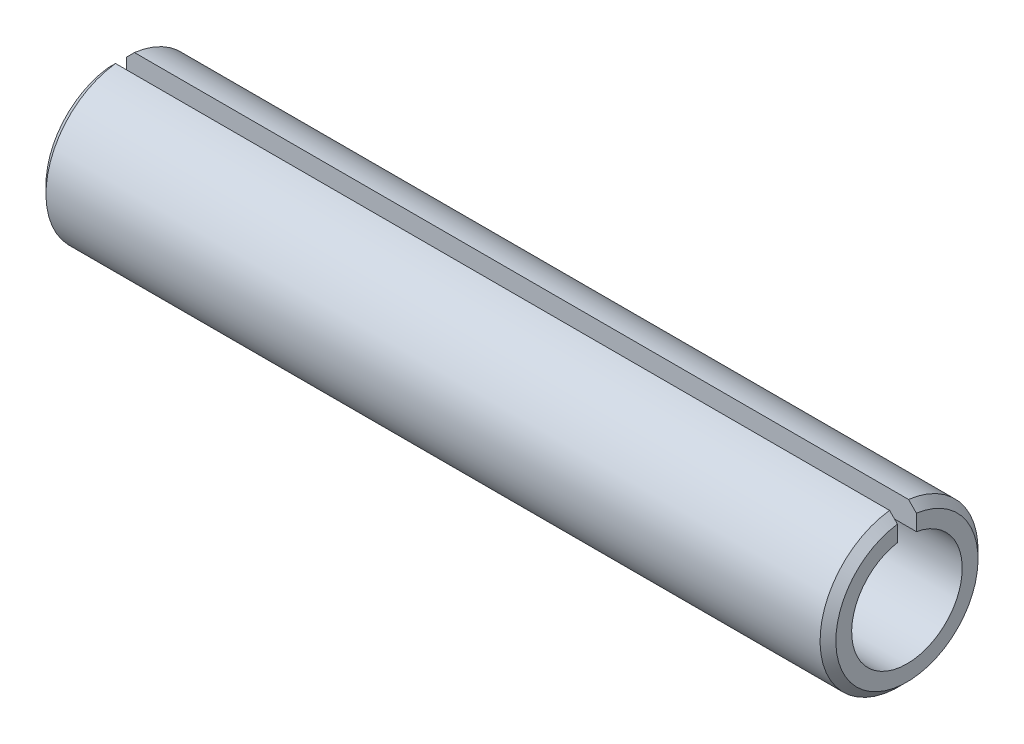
SolidWorks part; units mm, degrees
ref_plane "Plan1" through (0, 0, 0) normal (0, 0, 1) x (1, 0, 0)
ref_plane "Plan2" through (0, 0, 0) normal (0, 1, 0) x (1, 0, 0)
ref_plane "Plan3" through (0, 0, 0) normal (1, 0, 0) x (0, 0, -1)
sketch "Esquisse1" plane through (0, 0, 0) normal (0, 0, 1) x (1, 0, 0)
  line L0 (0, 1.4) -> (0, 1.8)
  line L1 (0, 1.4) -> (20, 1.4)
  line L2 (20, 1.4) -> (20, 1.8)
  line L3 (20, 1.8) -> (19.8, 2)
  line L4 (19.8, 2) -> (0.2, 2)
  line L5 (0.2, 2) -> (0, 1.8)
  line L6 (0, 0) -> (20, 0) construction
  dimension "D1" = 20
  dimension "D2" = 2
  dimension "D3" = 0.6
  dimension "D4" = 45
  dimension "D5" = 45
  dimension "D6" = 0.2
revolve "Base-Révolution" add sketch "Esquisse1" angle 360 about L6
sketch "Esquisse2" plane through (0, 0, 0) normal (1, 0, 0) x (0, 0, -1)
  line L0 (0, 0) -> (0, 2) construction
  line L1 (0.24, 1.9855) -> (0.24, 1.3793)
  line L2 (-0.24, 1.9855) -> (-0.24, 1.3793)
  circle A0 centre (0, 0) radius 2 construction
  circle A1 centre (0, 0) radius 1.4 construction
  arc A2 (0.24, 1.3793) -> (-0.24, 1.3793) centre (0, 0) ccw
  arc A3 (0.24, 1.9855) -> (-0.24, 1.9855) centre (0, 0) ccw
  dimension "D1" = 0.24
extrude "Enlèv. mat.-Extru.2" cut sketch "Esquisse2" along normal through all
equation "\"D6@Esquisse1\"=\"D2@Esquisse1\"/10"
equation "\"D1@Esquisse2\"=\"D3@Esquisse1\"/2.5"
